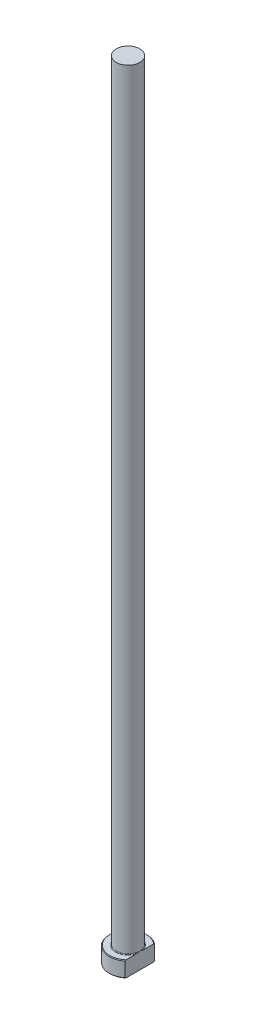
SolidWorks part; units mm, degrees
ref_plane "Front Plane" through (0, 0, 0) normal (0, 0, 1) x (1, 0, 0)
ref_plane "Top Plane" through (0, 0, 0) normal (0, 1, 0) x (1, 0, 0)
ref_plane "Right Plane" through (0, 0, 0) normal (1, 0, 0) x (0, 0, -1)
sketch "Sketch1" plane through (0, 0, 0) normal (0, 0, 1) x (1, 0, 0)
  line L0 (0, 259.9588) -> (0, -15.1925) construction
  line L1 (0, 0) -> (-6, 0)
  line L2 (-6, 0) -> (-6, 5)
  line L3 (-6, 5) -> (-3.75, 5)
  line L4 (-3.75, 5) -> (-3.75, 250)
  line L5 (-3.75, 250) -> (0, 250)
  line L6 (0, 250) -> (0, 0)
  dimension "L" = 250
  dimension "H" = 12
  dimension "T" = 5
  dimension "D" = 7.5
revolve "Revolve1" add sketch "Sketch1" angle 360 about L0
chamfer "Chamfer1" distance 0.2 angle 45 2 edges at (0, 5, 6) (0, 0, 6)
fillet "Fillet1" radius 0.2 1 edges at (0, 5, 3.75)
sketch "Sketch2" plane through (0, 0, 0) normal (0, 1, 0) x (1, 0, 0)
  line L0 (3.75, 4.6837) -> (3.75, -4.6837)
  circle A0 centre (0, 0) radius 6 construction
  arc A1 (3.75, -4.6837) -> (3.75, 4.6837) centre (0, 0) ccw
  circle A2 centre (0, 0) radius 3.75 construction
extrude "KEY" cut sketch "Sketch2" along normal through all
